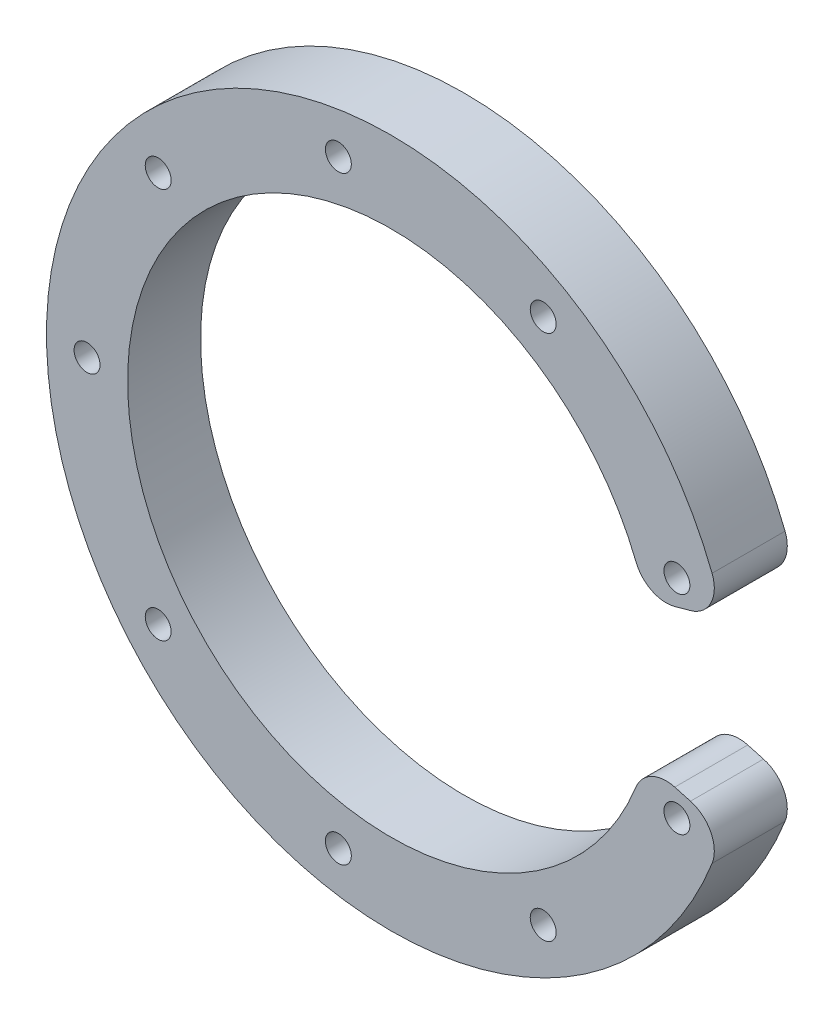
SolidWorks part; units mm, degrees
ref_plane "Front Plane" through (0, 0, 0) normal (0, 0, 1) x (1, 0, 0)
ref_plane "Top Plane" through (0, 0, 0) normal (0, 1, 0) x (1, 0, 0)
ref_plane "Right Plane" through (0, 0, 0) normal (1, 0, 0) x (0, 0, -1)
body saved out of another part "Stock-Hip Adapter Leg-1"
